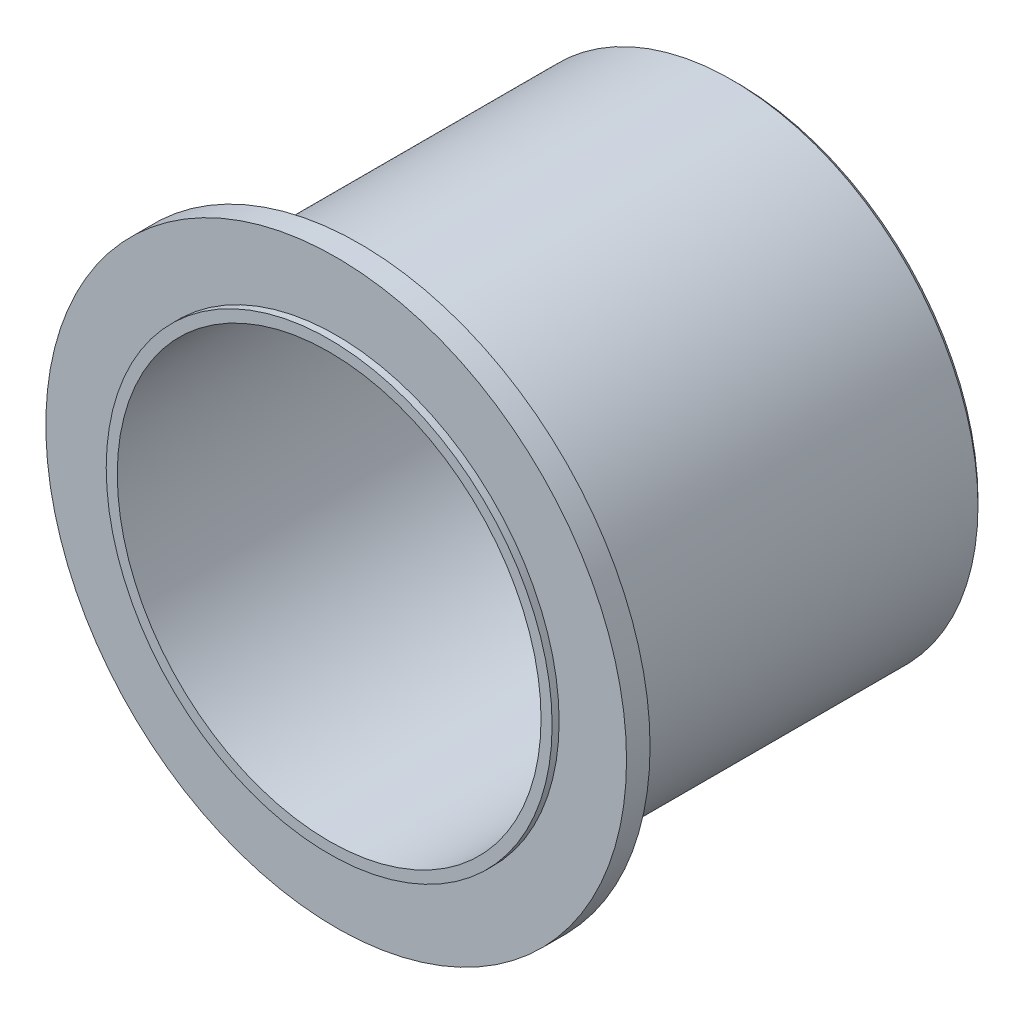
SolidWorks part; units mm, degrees
ref_plane "Ön Düzlem" through (0, 0, 0) normal (0, 0, 1) x (1, 0, 0)
ref_plane "Üst Düzlem" through (0, 0, 0) normal (0, 1, 0) x (1, 0, 0)
ref_plane "Sağ Düzlem" through (0, 0, 0) normal (1, 0, 0) x (0, 0, -1)
sketch "Çizim1" plane through (0, 0, 0) normal (0, 1, 0) x (1, 0, 0)
  line L0 (0, 0) -> (0, 58.15)
  line L1 (0, 58.15) -> (-35, 58.15)
  line L2 (-35, 58.15) -> (-35, 7.35)
  line L3 (-35, 7.35) -> (-41.35, 7.35)
  line L4 (-41.35, 7.35) -> (-41.35, 1)
  line L5 (-41.35, 1) -> (-31.75, 1)
  line L6 (-31.75, 1) -> (-31.75, 0)
  line L7 (-31.75, 0) -> (0, 0)
  dimension "D1" = 50.8
  dimension "D2" = 35
  dimension "D3" = 6.35
  dimension "D4" = 1
  dimension "D5" = 31.75
revolve "Döndür1" add sketch "Çizim1" angle 360 about L0
sketch "Çizim2" plane through (0, 0, -58.15) normal (0, 0, -1) x (-1, 0, 0)
  circle A0 centre (0, 0) radius 30.175
  dimension "D1" = 60.35
extrude "Kes-Ekstrüzyon1" cut sketch "Çizim2" against normal up to surface (58.15 mm away)
chamfer "Pah1" distance 0.75 angle 45 2 edges at (35, 0, -7.35) (35, 0, -58.15)
chamfer "Pah2" distance 3 angle 60 1 edges at (41.35, 0, -7.35)
fillet "Radyus1" radius 3 1 edges at (-30.175, 0, -58.15)
